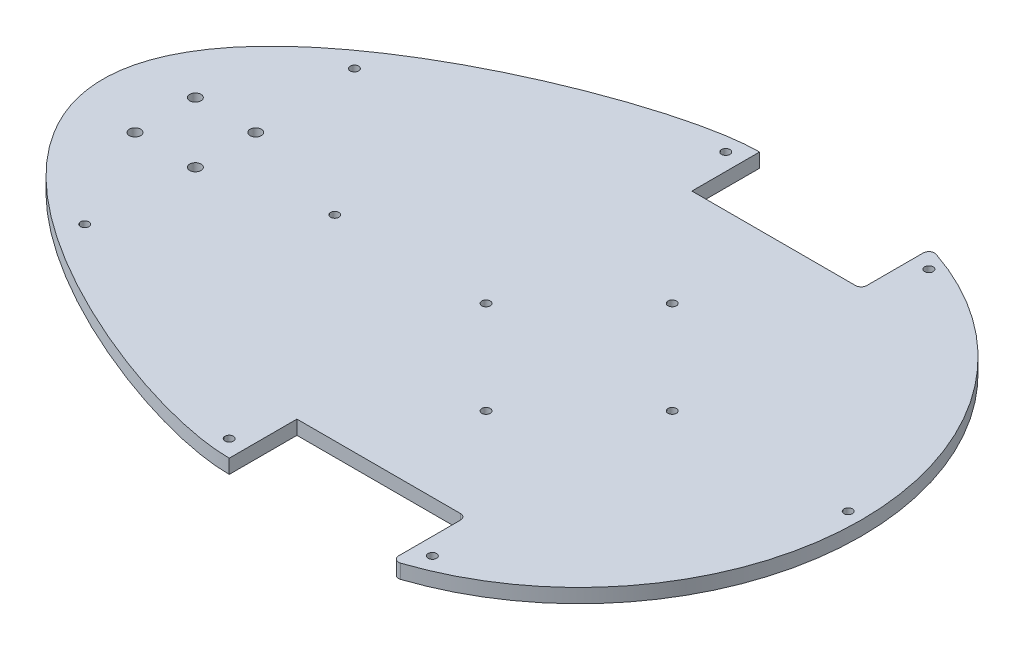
SolidWorks part; units mm, degrees
ref_plane "Front Plane" through (0, 0, 0) normal (0, 0, 1) x (1, 0, 0)
ref_plane "Top Plane" through (0, 0, 0) normal (0, 1, 0) x (1, 0, 0)
ref_plane "Right Plane" through (0, 0, 0) normal (1, 0, 0) x (0, 0, -1)
sketch "Sketch1" plane through (0, 0, 0) normal (0, 1, 0) x (1, 0, 0)
  line L0 (113.636, 127.2549) -> (113.636, 101.8549)
  line L1 (37.436, 129.7949) -> (-26.064, 129.7949) construction
  line L2 (-139.094, 40.9359) -> (-139.094, -22.5641) construction
  line L3 (37.436, -78.4851) -> (111.096, -78.4851)
  line L4 (37.436, 99.3149) -> (37.436, 129.7949)
  line L5 (113.636, -81.0251) -> (113.636, -108.8831)
  line L6 (-26.064, 129.7949) -> (-212.754, 40.8949) construction
  line L7 (37.436, -78.4851) -> (37.436, -108.9651)
  line L8 (-212.754, 40.8949) -> (-212.754, -20.0651) construction
  line L9 (37.436, 99.3149) -> (111.096, 99.3149)
  line L10 (-212.754, -20.0651) -> (-26.064, -108.9651) construction
  line L11 (-26.064, -108.9651) -> (37.436, -108.9651) construction
  arc A0 (116.9795, -111.2927) -> (116.9795, 129.6645) centre (76.806, 9.1859) ccw
  arc A1 (113.636, 127.2549) -> (116.9795, 129.6645) centre (116.176, 127.2549) cw
  arc A2 (113.636, -108.8831) -> (116.9795, -111.2927) centre (116.176, -108.8831) ccw
  arc A3 (111.096, -78.4851) -> (113.636, -81.0251) centre (111.096, -81.0251) cw
  arc A4 (111.096, 99.3149) -> (113.636, 101.8549) centre (111.096, 101.8549) ccw
  circle A5 centre (-83.595, -3.1741) radius 2.54
  circle A6 centre (-110.773, -3.1741) radius 2.54
  circle A7 centre (-110.773, 24.0039) radius 2.54
  circle A8 centre (-83.595, 24.0039) radius 2.54
  circle A9 centre (76.806, 51.0959) radius 1.905
  circle A11 centre (34.896, 9.1859) radius 1.905
  circle A12 centre (76.806, -32.7241) radius 1.905
  circle A13 centre (118.716, 9.1859) radius 1.905
  spline_without_curve S0
  point P16 (114.5137, 87.4439)
  point P51 (76.806, 9.1859)
  dimension "D3" = 254
  dimension "D6" = 2.54
  dimension "D19" = 3.81
  dimension "D1" = 30.48
  dimension "D2" = 76.2
  dimension "D4" = 76.2
  dimension "D5" = 36.83
  dimension "D7" = 30.48
  dimension "D8" = 215.9
  dimension "D9" = 63.5
  dimension "D10" = 31.75
  dimension "D11" = 63.5
  dimension "D12" = 63.5
  dimension "D13" = 73.66
  dimension "D14" = 177.8
  dimension "D15" = 25.4
  dimension "D16" = 88.9
  dimension "D17" = 88.9
  dimension "D18" = 41.91
  dimension "D21" = 27.178
  dimension "D22" = 27.178
  dimension "D23" = 75.311
  dimension "D24" = 121.031
  dimension "D20" = 4
extrude "Boss-Extrude1" add sketch "Sketch1" along normal blind 6.35
sketch "Sketch3" plane through (0, 6.35, 0) normal (0, 1, 0) x (1, 0, 0)
  line L0 (37.436, -78.4851) -> (111.096, -78.4851) construction
  line L1 (111.096, 99.3149) -> (37.436, 99.3149) construction
  line L2 (37.436, 99.3149) -> (37.436, 129.7949) construction
  line L3 (113.636, 127.2549) -> (113.636, 101.8549) construction
  circle A0 centre (121.256, -101.3451) radius 1.905
  circle A1 centre (121.256, 122.1749) radius 1.905
  circle A2 centre (29.816, 122.1749) radius 1.905
  circle A3 centre (29.816, -101.3451) radius 1.905
  circle A4 centre (-86.2919, -50.2911) radius 1.905
  circle A5 centre (-86.2919, 71.1209) radius 1.905
  circle A6 centre (197.456, 9.6529) radius 1.905
  circle A7 centre (-33.684, 9.6529) radius 1.905
  dimension "D1" = 3.81
  dimension "D2" = 3.81
  dimension "D3" = 3.81
  dimension "D4" = 3.81
  dimension "D5" = 3.81
  dimension "D6" = 3.81
  dimension "D7" = 3.81
  dimension "D8" = 3.81
  dimension "D9" = 28.194
  dimension "D10" = 28.194
  dimension "D11" = 22.86
  dimension "D12" = 22.86
  dimension "D13" = 7.62
  dimension "D14" = 7.62
  dimension "D15" = 89.662
  dimension "D16" = 71.12
  dimension "D17" = 83.82
extrude "Cut-Extrude2" cut sketch "Sketch3" against normal through all
